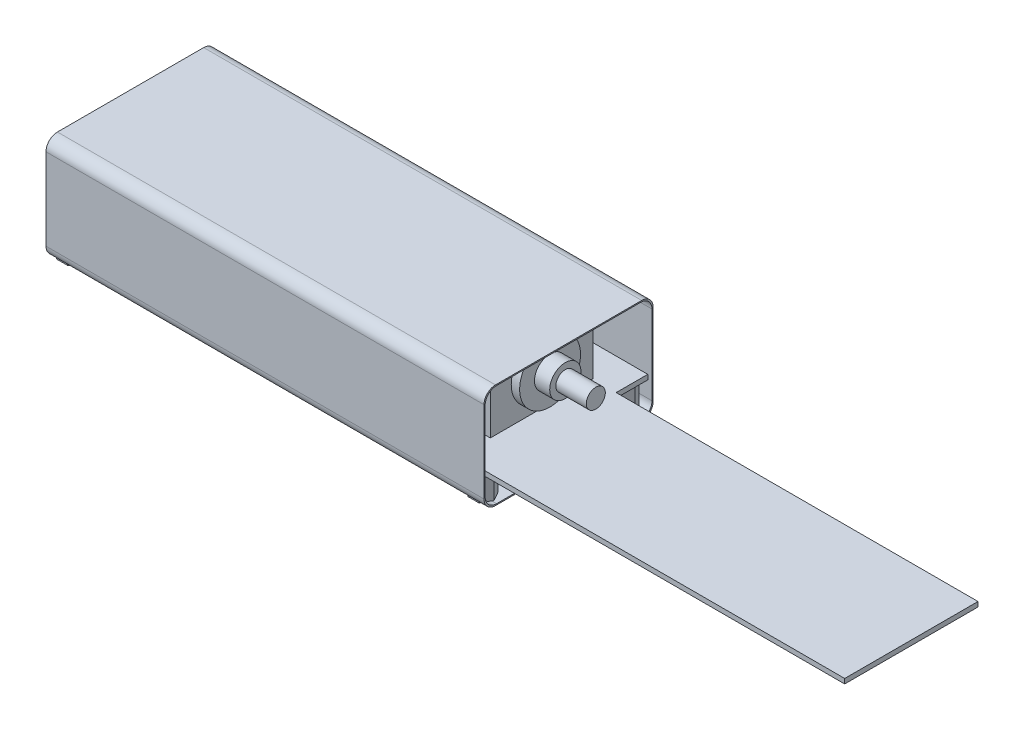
SolidWorks part; units mm, degrees
ref_plane "FRONT" through (0, 0, 0) normal (0, 0, 1) x (1, 0, 0)
ref_plane "TOP" through (0, 0, 0) normal (0, 1, 0) x (1, 0, 0)
ref_plane "RIGHT" through (0, 0, 0) normal (1, 0, 0) x (0, 0, -1)
sketch "Sketch1" plane through (0, 0, 0) normal (0, 1, 0) x (1, 0, 0)
  line L0 (0, 0) -> (145.034, 0)
  line L1 (0, 0) -> (0, 54.991)
  line L2 (145.034, 54.991) -> (0, 54.991)
  line L3 (145.034, 54.991) -> (145.034, 0)
  dimension "D1" = 145.034
  dimension "D2" = 54.991
extrude "Base-Extrude" add sketch "Sketch1" along normal blind 1.6002
sketch "Sketch2" plane through (0, 1.6002, 0) normal (0, 1, 0) x (-1, 0, 0)
  line L0 (0, 0) -> (-87.884, 0)
  line L1 (0, 0) -> (0, -54.991)
  line L2 (-87.884, -54.991) -> (0, -54.991)
  line L3 (-87.884, -54.991) -> (-87.884, 0)
  line L4 (-145.034, -54.991) -> (0, -54.991) construction
  dimension "D1" = 87.884
extrude "Boss-Extrude1" add sketch "Sketch2" along normal blind 12.7
sketch "Sketch16" plane through (0, 0, 0) normal (-1, 0, 0) x (0, 0, 1)
  line L0 (0, 0) -> (-54.991, 0) construction
  line L1 (-37.6555, 8.89) -> (-17.3355, 8.89)
  line L2 (-37.6555, 8.89) -> (-37.6555, 18.034)
  line L3 (-37.6555, 18.034) -> (-17.3355, 18.034)
  line L4 (-17.3355, 8.89) -> (-17.3355, 18.034)
  line L5 (-27.4955, 8.89) -> (-27.4955, 0) construction
  dimension "D1" = 8.89
  dimension "D2" = 9.144
  dimension "D3" = 20.32
extrude "Conn Comm" add sketch "Sketch16" along normal blind 2.54 and the other way blind 6.35
sketch "Sketch17" plane through (0, 1.6002, 0) normal (0, 1, 0) x (-1, 0, 0)
  line L0 (-87.884, -54.991) -> (0, -54.991) construction
  line L1 (-2.54, -52.451) -> (-7.62, -52.451)
  line L2 (-2.54, -52.451) -> (-2.54, -42.291)
  line L3 (-2.54, -42.291) -> (-7.62, -42.291)
  line L4 (-7.62, -52.451) -> (-7.62, -42.291)
  line L5 (-33.02, -7.62) -> (-40.64, -7.62)
  line L6 (-33.02, -7.62) -> (-33.02, -5.08)
  line L7 (-33.02, -5.08) -> (-40.64, -5.08)
  line L8 (-40.64, -7.62) -> (-40.64, -5.08)
  line L9 (0, -37.6555) -> (0, -54.991) construction
  line L10 (0, 0) -> (-87.884, 0) construction
  line L11 (0, 0) -> (0, -17.3355) construction
  dimension "D1" = 10.16
  dimension "D2" = 5.08
  dimension "D3" = 2.54
  dimension "D4" = 2.54
  dimension "D5" = 5.08
  dimension "D6" = 7.62
  dimension "D7" = 2.54
  dimension "D8" = 33.02
extrude "Conn Pins" add sketch "Sketch17" along direction (0, -1, 0) on the side of the normal blind 16.51 separate body
sketch "Sketch14" plane through (0, 0, 0) normal (0, -1, 0) x (1, 0, 0)
  line L1 (57.7366, -8.0534) -> (77.7894, -8.0534)
  line L2 (57.7366, -8.0534) -> (57.7366, -20.7534)
  line L3 (57.7366, -20.7534) -> (77.7894, -20.7534)
  line L4 (77.7894, -8.0534) -> (77.7894, -20.7534)
  line L5 (57.7366, -32.1084) -> (77.7894, -32.1084)
  line L6 (57.7366, -32.1084) -> (57.7366, -44.8084)
  line L7 (57.7366, -44.8084) -> (77.7894, -44.8084)
  line L8 (77.7894, -32.1084) -> (77.7894, -44.8084)
  dimension "D1" = 12.7
extrude "Coils" add sketch "Sketch14" along normal blind 9.525
sketch "Sketch3" plane through (0, 1.6002, 0) normal (0, 1, 0) x (-1, 0, 0)
  line L0 (-117.0305, -27.4955) -> (-145.796, -27.4955) construction
  line L1 (-145.034, -27.4955) -> (-124.714, -27.4955) construction
  line L2 (-145.034, -54.991) -> (-145.034, 0) construction
  line L3 (-137.16, -10.3505) -> (-137.16, -44.6405)
  line L4 (-137.16, -44.6405) -> (-124.714, -44.6405)
  line L5 (-137.16, -10.3505) -> (-124.714, -10.3505)
  line L6 (-124.714, -44.6405) -> (-124.714, -10.3505)
  point P7 (-137.16, -27.4955)
  point P10 (-124.714, -27.4955)
  dimension "D1" = 12.446
  dimension "D2" = 34.29
  dimension "D3" = 20.32
  dimension "D4" = 90
extrude "Boss-Extrude2" add sketch "Sketch3" along normal blind 22.606
ref_plane "Plane4" through (0, 13.5382, 0) normal (0, 1, 0) x (-1, 0, 0)
sketch "Sketch4" plane through (0, 13.5382, 0) normal (0, 1, 0) x (-1, 0, 0)
  line L0 (-137.16, -27.4955) -> (-155.194, -27.4955) construction
  line L1 (-137.16, -10.3505) -> (-137.16, -44.6405) construction
  line L2 (-155.194, -27.4955) -> (-155.194, -30.6705)
  line L3 (-155.194, -30.6705) -> (-145.034, -30.6705)
  line L4 (-145.034, -30.6705) -> (-145.034, -32.7025)
  line L5 (-145.034, -32.7025) -> (-139.954, -32.7025)
  line L6 (-139.954, -32.7025) -> (-139.954, -37.6555)
  line L7 (-139.954, -37.6555) -> (-137.16, -37.6555)
  line L8 (-137.16, -37.6555) -> (-137.16, -27.4955)
  line L9 (-137.16, -27.4955) -> (-155.194, -27.4955)
  point P17 (-155.194, -27.4955)
  dimension "D1" = 3.175
  dimension "D2" = 5.207
  dimension "D3" = 10.16
  dimension "D4" = 10.16
  dimension "D5" = 5.08
  dimension "D6" = 2.794
revolve "Boss-Revolve1" add sketch "Sketch4" angle 360 about L0
sketch "Sketch5" plane through (0, 13.5382, 0) normal (0, 1, 0) x (-1, 0, 0)
  line L0 (-124.714, -27.4955) -> (-108.889, -27.4955) construction
  line L1 (-124.714, -44.6405) -> (-124.714, -10.3505) construction
  line L2 (-124.714, -27.4955) -> (-124.714, -36.3855)
  line L3 (-124.714, -36.3855) -> (-122.936, -36.3855)
  line L4 (-122.936, -36.3855) -> (-122.936, -38.6715)
  line L5 (-122.936, -38.6715) -> (-105.918, -38.6715)
  line L6 (-105.918, -38.6715) -> (-105.918, -31.9405)
  line L7 (-105.918, -31.9405) -> (-96.393, -31.9405)
  line L8 (-96.393, -31.9405) -> (-96.393, -27.4955)
  line L9 (-96.393, -27.4955) -> (-124.714, -27.4955)
  line L10 (-124.714, -44.6405) -> (-124.714, -10.3505) construction
  dimension "D1" = 8.89
  dimension "D2" = 11.176
  dimension "D3" = 4.445
  dimension "D4" = 1.778
  dimension "D5" = 17.018
  dimension "D6" = 9.525
revolve "Boss-Revolve2" add sketch "Sketch5" angle 360 about L0
sketch "Sketch6" plane through (0, 0, 0) normal (0, -1, 0) x (1, 0, 0)
  line L0 (0, 0) -> (145.034, 0) construction
  line L1 (139.2639, -7.1755) -> (142.9301, -7.1755)
  line L2 (142.9301, -7.1755) -> (144.7632, -4.0005)
  line L3 (144.7632, -4.0005) -> (142.9301, -0.8255)
  line L4 (142.9301, -0.8255) -> (139.2639, -0.8255)
  line L5 (139.2639, -0.8255) -> (137.4308, -4.0005)
  line L6 (137.4308, -4.0005) -> (139.2639, -7.1755)
  line L7 (137.4308, -50.9905) -> (139.2639, -54.1655)
  line L8 (139.2639, -54.1655) -> (142.9301, -54.1655)
  line L9 (142.9301, -54.1655) -> (144.7632, -50.9905)
  line L10 (144.7632, -50.9905) -> (142.9301, -47.8155)
  line L11 (142.9301, -47.8155) -> (139.2639, -47.8155)
  line L12 (139.2639, -47.8155) -> (137.4308, -50.9905)
  line L13 (145.034, -54.991) -> (145.034, 0) construction
  line L15 (2.1039, -7.1755) -> (5.7701, -7.1755)
  line L16 (5.7701, -7.1755) -> (7.6032, -4.0005)
  line L17 (7.6032, -4.0005) -> (5.7701, -0.8255)
  line L18 (5.7701, -0.8255) -> (2.1039, -0.8255)
  line L19 (2.1039, -0.8255) -> (0.2708, -4.0005)
  line L20 (0.2708, -4.0005) -> (2.1039, -7.1755)
  line L21 (0.2708, -50.9905) -> (2.1039, -54.1655)
  line L22 (2.1039, -54.1655) -> (5.7701, -54.1655)
  line L23 (5.7701, -54.1655) -> (7.6032, -50.9905)
  line L24 (7.6032, -50.9905) -> (5.7701, -47.8155)
  line L25 (5.7701, -47.8155) -> (2.1039, -47.8155)
  line L26 (2.1039, -47.8155) -> (0.2708, -50.9905)
  line L27 (3.937, -4.0005) -> (141.097, -50.9905) construction
  line L28 (3.937, -4.0005) -> (141.097, -4.0005) construction
  line L29 (3.937, -4.0005) -> (3.937, -50.9905) construction
  line L30 (3.937, -50.9905) -> (141.097, -50.9905) construction
  line L31 (141.097, -4.0005) -> (141.097, -50.9905) construction
  line L32 (0, -54.991) -> (145.034, 0) construction
  circle A0 centre (141.097, -4.0005) radius 3.175 construction
  circle A1 centre (141.097, -50.9905) radius 3.175 construction
  circle A2 centre (3.937, -4.0005) radius 3.175 construction
  circle A3 centre (3.937, -50.9905) radius 3.175 construction
  circle A4 centre (3.937, -4.0005) radius 1.27
  circle A5 centre (141.097, -4.0005) radius 1.27
  circle A6 centre (141.097, -50.9905) radius 1.27
  circle A7 centre (3.937, -50.9905) radius 1.27
  point P38 (72.517, -27.4955)
  dimension "D1" = 6.35
  dimension "D2" = 6.35
  dimension "D4" = 46.99
  dimension "D6" = 6.35
  dimension "D7" = 6.35
  dimension "D3" = 2.54
  dimension "D8" = 137.16
  dimension "D9" = 46.99
extrude "HexStndOff" add sketch "Sketch6" along normal blind 9.525
sketch "Sketch7" plane through (0, 0, 0) normal (1, 0, 0) x (0, 0, -1)
  line L0 (3.556, 24.5872) -> (51.562, 24.5872)
  line L1 (3.175, 24.9682) -> (51.943, 24.9682)
  line L2 (-0.635, 21.1582) -> (-0.635, -6.096)
  line L3 (3.175, -9.906) -> (51.943, -9.906)
  line L4 (55.753, 21.1582) -> (55.753, -6.096)
  line L5 (55.372, 20.7772) -> (55.372, -5.715)
  line L6 (3.556, -9.525) -> (51.562, -9.525)
  line L7 (-0.254, 20.7772) -> (-0.254, -5.715)
  line L8 (44.6405, 24.2062) -> (10.3505, 24.2062) construction
  line L10 (54.991, 14.3002) -> (54.991, 0) construction
  line L12 (47.8155, -9.525) -> (50.9905, -9.525) construction
  arc A1 (51.562, 24.5872) -> (55.372, 20.7772) centre (51.562, 20.7772) cw
  arc A2 (51.943, 24.9682) -> (55.753, 21.1582) centre (51.943, 21.1582) cw
  arc A3 (3.556, 24.5872) -> (-0.254, 20.7772) centre (3.556, 20.7772) ccw
  arc A4 (3.175, 24.9682) -> (-0.635, 21.1582) centre (3.175, 21.1582) ccw
  arc A5 (55.372, -5.715) -> (51.562, -9.525) centre (51.562, -5.715) cw
  arc A6 (51.943, -9.906) -> (55.753, -6.096) centre (51.943, -6.096) ccw
  arc A7 (3.556, -9.525) -> (-0.254, -5.715) centre (3.556, -5.715) cw
  arc A8 (-0.635, -6.096) -> (3.175, -9.906) centre (3.175, -6.096) ccw
  point P14 (55.753, 24.9682)
  point P19 (-0.635, 24.9682)
  point P28 (-0.635, -9.906)
  dimension "D3" = 0.762
  dimension "D4" = 0.762
  dimension "D6" = 3.81
  dimension "D1" = 56.388
  dimension "D5" = 0.381
extrude "Shield" add sketch "Sketch7" along normal blind 146.05
sketch "Fiber ends" plane through (155.194, 0, 0) normal (1, 0, 0) x (0, 0, -1)
  circle A0 centre (25.9715, 13.5382) radius 1.397
  circle A1 centre (29.0195, 13.5382) radius 1.397
  circle A2 centre (27.4955, 13.5382) radius 3.175 construction
  point P0 (27.4955, 13.5382)
  dimension "D1" = 2.794
  dimension "D2" = 1.524
  dimension "D3" = 1.524
sketch "Fiber paths" plane through (0, 13.5382, 0) normal (0, 1, 0) x (-1, 0, 0)
  line L0 (-155.194, -29.0195) -> (-167.894, -29.0195)
  line L1 (-155.194, -25.9715) -> (-167.894, -25.9715)
  line L2 (-155.194, -29.0195) -> (-155.194, -25.9715) construction
  dimension "D1" = 12.7
sketch "Sketch18" plane through (0, -9.906, 0) normal (0, -1, 0) x (1, 0, 0)
  circle A1 centre (3.937, -50.9905) radius 1.27
  circle A2 centre (3.937, -50.9905) radius 1.27
  circle A3 centre (141.097, -50.9905) radius 1.27
  circle A4 centre (141.097, -50.9905) radius 1.27
  circle A5 centre (141.097, -4.0005) radius 1.27
  circle A6 centre (141.097, -4.0005) radius 1.27
  circle A7 centre (3.937, -4.0005) radius 1.27
  circle A8 centre (3.937, -4.0005) radius 1.27
  dimension "D4" = 0
  dimension "D5" = 0
  dimension "D6" = 0
  dimension "D7" = 0
extrude "Cut-Extrude1" cut sketch "Sketch18" against normal blind 6.35
sketch "Sketch19" plane through (145.034, 0, 0) normal (1, 0, 0) x (0, 0, -1)
  line L0 (54.991, 0) -> (0, 0) construction
  line L1 (0, 1.6002) -> (44.45, 1.6002)
  line L2 (0, 1.6002) -> (0, 0)
  line L3 (0, 0) -> (44.45, 0)
  line L4 (44.45, 1.6002) -> (44.45, 0)
  dimension "D1" = 44.45
extrude "Extrude1" add sketch "Sketch19" along normal blind 120.65
